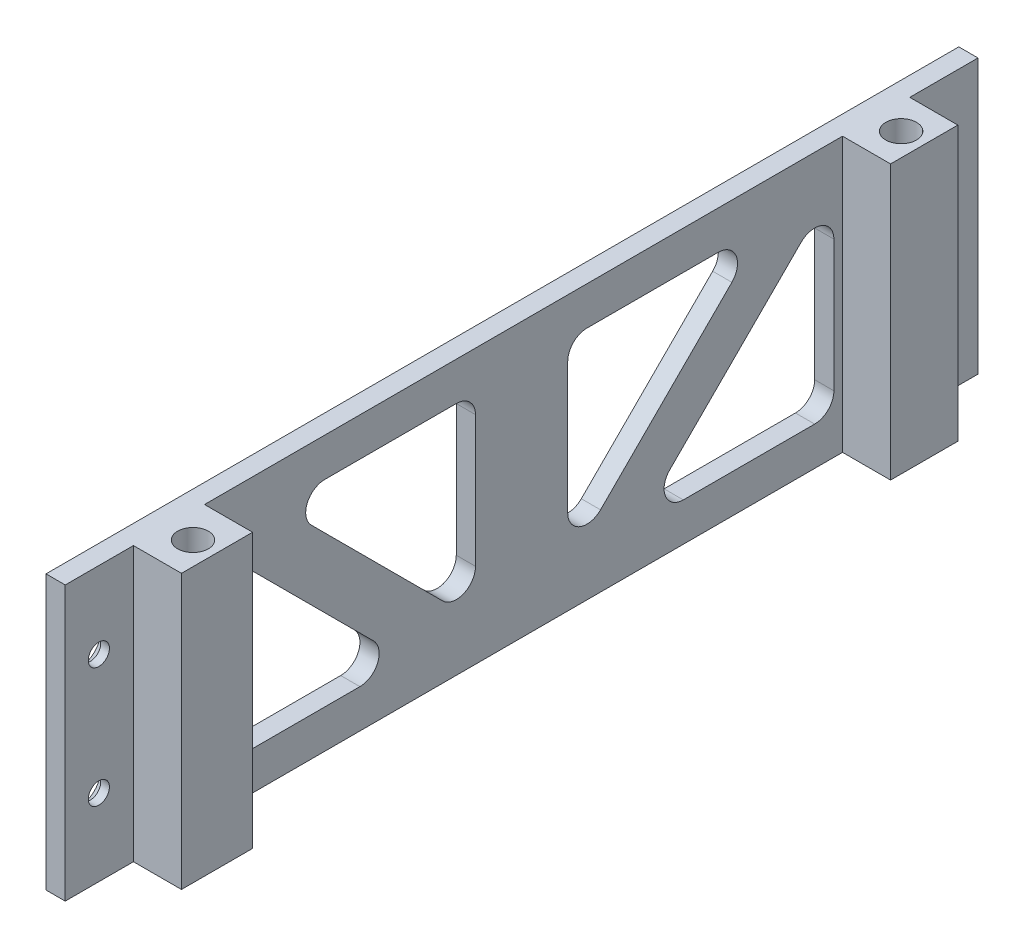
SolidWorks part; units mm, degrees
ref_plane "Front Plane" through (0, 0, 0) normal (0, 0, 1) x (1, 0, 0)
ref_plane "Top Plane" through (0, 0, 0) normal (0, 1, 0) x (1, 0, 0)
ref_plane "Right Plane" through (0, 0, 0) normal (1, 0, 0) x (0, 0, -1)
sketch "Sketch1" plane through (0, 0, 0) normal (1, 0, 0) x (0, 0, -1)
  line L1 (47.5, 14.25) -> (-47.5, 14.25)
  line L2 (47.5, 14.25) -> (47.5, -14.25)
  line L3 (47.5, -14.25) -> (-47.5, -14.25)
  line L4 (-47.5, 14.25) -> (-47.5, -14.25)
  line L5 (47.5, 14.25) -> (-47.5, -14.25) construction
  line L6 (47.5, -14.25) -> (-47.5, 14.25) construction
  point P0 (0, 0)
  dimension "D1" = 95
  dimension "D2" = 28.5
extrude "Boss-Extrude1" add sketch "Sketch1" along normal blind 2
sketch "Sketch3" plane through (2, 0, 0) normal (1, 0, 0) x (0, 0, -1)
  line L0 (-47.5, -14.25) -> (47.5, -14.25) construction
  line L1 (-40.4, -14.25) -> (-33, -14.25)
  line L2 (-40.4, -14.25) -> (-40.4, 14.25)
  line L3 (-40.4, 14.25) -> (-33, 14.25)
  line L4 (-33, -14.25) -> (-33, 14.25)
  line L5 (47.5, 14.25) -> (-47.5, 14.25) construction
  line L6 (-47.5, 14.25) -> (-47.5, -14.25) construction
  line L7 (47.5, -14.25) -> (47.5, 14.25) construction
  line L8 (40.4, 14.25) -> (33.4, 14.25)
  line L9 (40.4, 14.25) -> (40.4, -14.25)
  line L10 (40.4, -14.25) -> (33.4, -14.25)
  line L11 (33.4, 14.25) -> (33.4, -14.25)
  dimension "D1" = 7.1
  dimension "D2" = 7.4
  dimension "D3" = 7
  dimension "D4" = 7.1
extrude "Boss-Extrude3" add sketch "Sketch3" along normal blind 5
hole_wizard "Ø3.2 (3.2) Diameter Hole1" positions "Sketch5" profile "Sketch4" hole size "Ø3.2" standard "ISO"
sketch "Sketch5" plane through (0, 14.25, 0) normal (0, 1, 0) x (1, 0, 0)
  line L0 (0, 47.5) -> (0, -47.5) construction
  line L1 (2, 47.5) -> (0, 47.5) construction
  line L2 (2, -47.5) -> (0, -47.5) construction
  point P0 (4.6, 36.9)
  point P2 (4.6, -36.8)
  point P7 (1, 47.5)
  point P10 (1, -47.5)
  dimension "D1" = 4.6
  dimension "D2" = 10.6
  dimension "D3" = 10.7
  dimension "D4" = 4.6
sketch "Sketch4" plane through (4.6, 14.25, -36.9) normal (1, 0, 0) x (0, 0, 1)
  line L0 (0, 0) -> (0, 28.5001)
  line L1 (0, 28.5001) -> (1.6, 28.5001)
  line L2 (1.6, 28.5001) -> (1.6, 0)
  line L5 (1.6, 0) -> (0, 0)
  line L11 (0, -6.35) -> (0, 107.95) construction
  dimension "Thru Hole Dia." = 3.2
  dimension "Thru Hole Depth" = 28.5001
hole_wizard "CSK for M2 Countersunk Flat Head Screw1" positions "Sketch7" profile "Sketch6" countersink size "M2" standard "ISO"
sketch "Sketch7" plane through (0, 0, 0) normal (-1, 0, 0) x (0, 0, 1)
  line L1 (-47.5, -14.25) -> (-47.5, 14.25) construction
  line L4 (47.5, -14.25) -> (-47.5, -14.25) construction
  line L5 (-47.5, 14.25) -> (47.5, 14.25) construction
  line L6 (47.5, 14.25) -> (47.5, -14.25) construction
  point P0 (-44, 6.25)
  point P2 (-44, -6.25)
  point P4 (44, 6.25)
  point P6 (44, -6.25)
  dimension "D1" = 3.5
  dimension "D2" = 3.5
  dimension "D3" = 8
  dimension "D4" = 8
  dimension "D5" = 3.5
  dimension "D6" = 8
  dimension "D7" = 3.5
  dimension "D8" = 8
sketch "Sketch6" plane through (0, 6.25, -44) normal (0, 1, 0) x (0, 0, 1)
  line L0 (0, 0) -> (0, 2.6609)
  line L1 (0, 2.6609) -> (1.1, 2)
  line L2 (1.1, 2) -> (1.1, 1.1)
  line L3 (1.1, 1.1) -> (2.2, 0)
  line L5 (2.2, 0) -> (0, 0)
  line L6 (-1.1, 1.1) -> (-2.2, 0) construction
  line L10 (0, 2.6609) -> (-1.1, 2) construction
  line L11 (0, -6.35) -> (0, 107.95) construction
  dimension "Hole Dia." = 2.2
  dimension "Hole Depth" = 2
  dimension "Near C'Sink Dia." = 4.4
  dimension "Near C'Sink Angle" = 90
  dimension "Drill Angle" = 118
sketch "Sketch8" plane through (0, 0, 0) normal (-1, 0, 0) x (0, 0, 1)
  line L0 (-32.5, 5.4216) -> (-32.5, -8.25)
  line L1 (-30.5, -10.25) -> (-16.8284, -10.25)
  line L2 (-15.4142, -6.8358) -> (-29.0858, 6.8358)
  line L3 (-20.4716, 10.25) -> (-6.8, 10.25)
  line L4 (-4.8, 8.25) -> (-4.8, -5.4216)
  line L5 (-8.2142, -6.8358) -> (-21.8858, 6.8358)
  line L6 (-47.5, 14.25) -> (47.5, 14.25) construction
  line L7 (47.5, -14.25) -> (-47.5, -14.25) construction
  line L8 (-47.5, -14.25) -> (-47.5, 14.25) construction
  arc A0 (-6.8, 10.25) -> (-4.8, 8.25) centre (-6.8, 8.25) cw
  arc A1 (-20.4716, 10.25) -> (-21.8858, 6.8358) centre (-20.4716, 8.25) ccw
  arc A2 (-4.8, -5.4216) -> (-8.2142, -6.8358) centre (-6.8, -5.4216) cw
  arc A3 (-16.8284, -10.25) -> (-15.4142, -6.8358) centre (-16.8284, -8.25) ccw
  arc A4 (-32.5, -8.25) -> (-30.5, -10.25) centre (-30.5, -8.25) ccw
  arc A5 (-32.5, 5.4216) -> (-29.0858, 6.8358) centre (-30.5, 5.4216) cw
  point P16 (-25.3, 10.25)
  point P19 (-4.8, -10.25)
  point P26 (-32.5, 10.25)
  dimension "D9" = 2
  dimension "D1" = 4
  dimension "D2" = 4
  dimension "D3" = 45
  dimension "D4" = 7.2
  dimension "D5" = 4
  dimension "D6" = 4
  dimension "D7" = 45
  dimension "D8" = 15
extrude "Cut-Extrude1" cut sketch "Sketch8" against normal blind 10
mirror "Mirror1" about plane through (0, 0, 0) normal (0, 0, 1) of "Cut-Extrude1"
